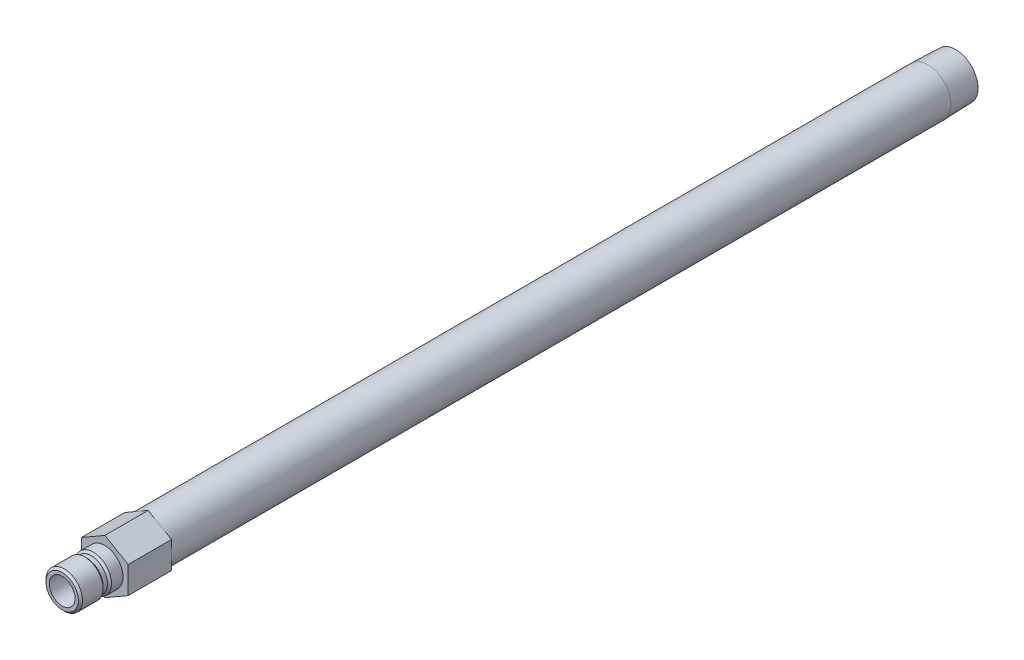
SolidWorks part; units mm, degrees
ref_plane "Front Plane" through (0, 0, 0) normal (0, 0, 1) x (1, 0, 0)
ref_plane "Top Plane" through (0, 0, 0) normal (0, 1, 0) x (1, 0, 0)
ref_plane "Right Plane" through (0, 0, 0) normal (1, 0, 0) x (0, 0, -1)
sketch "Sketch1" plane through (0, 0, 0) normal (1, 0, 0) x (0, 0, -1)
  line L0 (0, 0) -> (-18.923, 0) construction
  line L1 (-15.748, 4.7625) -> (-15.748, 5.9817)
  line L2 (-6.604, 5.9817) -> (-6.604, 0) construction
  line L3 (-14.986, 6.7437) -> (-7.366, 6.7437)
  line L4 (0, 8.5725) -> (0, 0) construction
  line L5 (-6.604, 5.9817) -> (-5.0165, 5.9817)
  line L6 (-4.2545, 6.7437) -> (0, 6.7437)
  line L7 (0, 6.7437) -> (0, 8.5725)
  line L8 (-6.604, 5.9817) -> (-7.366, 6.7437)
  line L9 (-5.0165, 5.9817) -> (-4.2545, 6.7437)
  line L10 (-15.748, 5.9817) -> (-14.986, 6.7437)
  line L11 (-15.748, 4.7625) -> (16.002, 4.7625)
  line L12 (0, 8.5725) -> (304.1142, 8.5725)
  line L13 (304.1142, 8.5725) -> (314.452, 8.2494)
  line L14 (314.452, 8.2494) -> (314.452, 6.2611)
  line L15 (0, 6.7437) -> (16.002, 6.7437) construction
  line L16 (16.002, 6.7437) -> (16.002, 0) construction
  line L17 (16.002, 0) -> (0, 0) construction
  line L18 (16.002, 4.7625) -> (16.002, 6.2611)
  line L19 (16.002, 6.2611) -> (314.452, 6.2611)
  dimension "D1" = 15.748
  dimension "D2" = 1.5875
  dimension "D3" = 0.762
  dimension "D4" = 45
  dimension "D5" = 9.144
  dimension "D6" = 45
  dimension "D7" = 1.79
  dimension "D8" = 10.3378
  dimension "D9" = 330.2
  dimension "D10" = 3.175
  dimension "D11" = 9.525
  dimension "D12" = 17.145
  dimension "D13" = 31.75
  dimension "D14" = 13.4874
  dimension "D15" = 12.5222
revolve "Revolve1" add sketch "Sketch1" angle 360 about L0
sketch "Sketch2" plane through (0, 0, 0) normal (0, 0, 1) x (1, 0, 0)
  line L1 (-8.636, 4.986) -> (-8.636, -4.986)
  line L2 (-8.636, -4.986) -> (0, -9.972)
  line L3 (0, -9.972) -> (8.636, -4.986)
  line L4 (8.636, -4.986) -> (8.636, 4.986)
  line L5 (8.636, 4.986) -> (0, 9.972)
  line L6 (0, 9.972) -> (-8.636, 4.986)
  circle A0 centre (0, 0) radius 8.636 construction
  circle A1 centre (0, 0) radius 4.7625 construction
  circle A2 centre (0, 0) radius 4.7625
  dimension "D1" = 17.272
extrude "Boss-Extrude1" add sketch "Sketch2" against normal up to vertex (16.002 mm away) from vertex at 0
